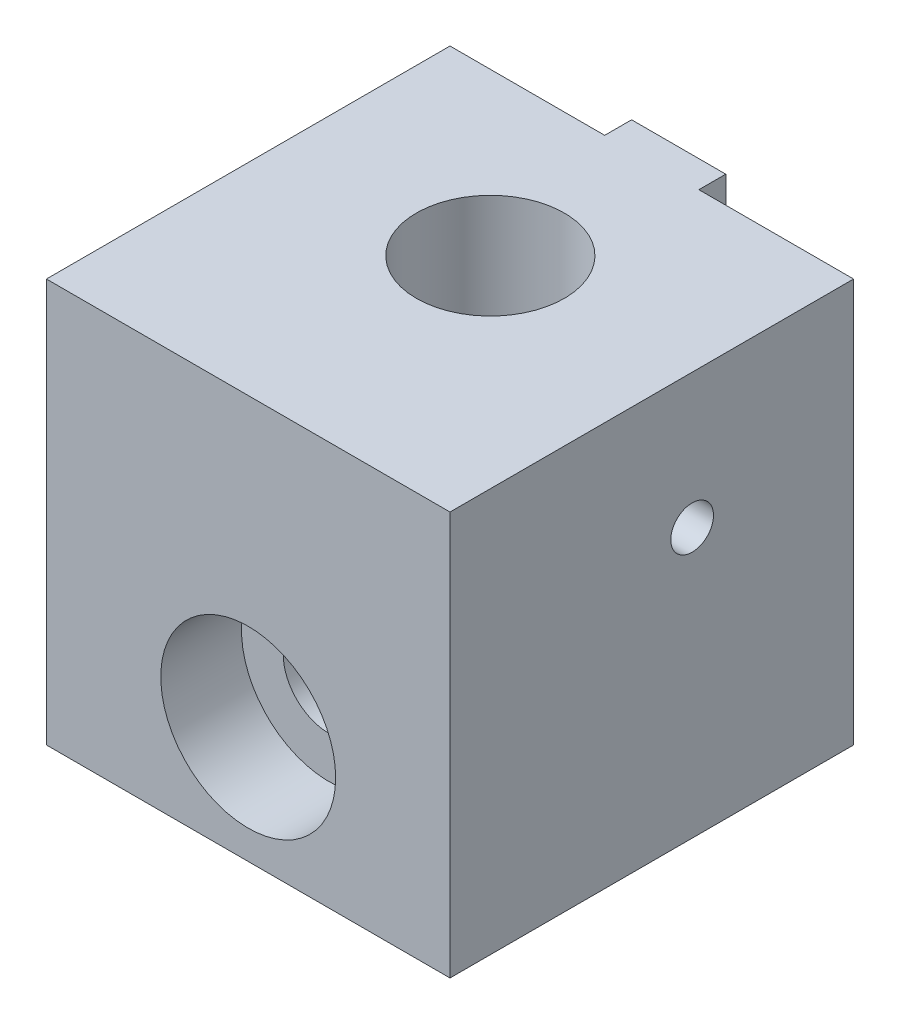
SolidWorks part; units mm, degrees
ref_plane "Front Plane" through (0, 0, 0) normal (0, 0, 1) x (1, 0, 0)
ref_plane "Top Plane" through (0, 0, 0) normal (0, 1, 0) x (1, 0, 0)
ref_plane "Right Plane" through (0, 0, 0) normal (1, 0, 0) x (0, 0, -1)
sketch "Sketch1" plane through (0, 0, 0) normal (0, 0, 1) x (1, 0, 0)
  line L1 (-7.5, -7.5) -> (7.5, -7.5)
  line L2 (-7.5, -7.5) -> (-7.5, 7.5)
  line L3 (-7.5, 7.5) -> (7.5, 7.5)
  line L4 (7.5, -7.5) -> (7.5, 7.5)
  line L5 (-7.5, -7.5) -> (7.5, 7.5) construction
  line L6 (-7.5, 7.5) -> (7.5, -7.5) construction
  point P0 (0, 0)
  dimension "D1" = 15
  dimension "D2" = 15
extrude "Boss-Extrude1" add sketch "Sketch1" along normal blind 15
sketch "Sketch8" plane through (0, 0, 0) normal (0, 0, -1) x (-1, 0, 0)
  line L0 (-7.5, 7.5) -> (7.5, 7.5) construction
  line L1 (-1.75, -7.5) -> (1.75, -7.5)
  line L2 (-1.75, -7.5) -> (-1.75, 7.5)
  line L3 (-1.75, 7.5) -> (1.75, 7.5)
  line L4 (1.75, -7.5) -> (1.75, 7.5)
  line L5 (-1.75, -7.5) -> (1.75, 7.5) construction
  line L6 (-1.75, 7.5) -> (1.75, -7.5) construction
  point P0 (0, 0)
  dimension "D1" = 3.5
extrude "Boss-Extrude2" add sketch "Sketch8" along normal blind 1
hole_wizard "CBORE for M3 SHCS1" positions "Sketch5" profile "Sketch4" counterbore size "M3" standard "ANSI Metric"
sketch "Sketch5" plane through (0, 0, 15) normal (0, 0, 1) x (1, 0, 0)
  point P0 (0, -3.1778)
sketch "Sketch4" plane through (0, -3.1778, 15) normal (1, 0, 0) x (0, -1, 0)
  line L0 (0, 0) -> (0, 16)
  line L1 (0, 16) -> (1.7, 16)
  line L3 (1.7, 16) -> (1.7, 3)
  line L4 (1.7, 3) -> (3.25, 3)
  line L5 (3.25, 3) -> (3.25, 0)
  line L7 (3.25, 0) -> (0, 0)
  line L11 (0, -6.35) -> (0, 107.95) construction
  dimension "Thru Hole Dia." = 3.4
  dimension "Thru Hole Depth" = 16
  dimension "C'Bore Dia." = 6.5
  dimension "C'Bore Depth" = 3
sketch "Sketch6" plane through (0, 7.5, 0) normal (0, 1, 0) x (1, 0, 0)
  line L0 (0, 1) -> (0, -6) construction
  line L1 (-1.75, 1) -> (1.75, 1) construction
  line L2 (7.5, 0) -> (1.75, 0) construction
  circle A0 centre (0, -6) radius 2.75
  dimension "D1" = 5.5
  dimension "D2" = 6
extrude "Cut-Extrude1" cut sketch "Sketch6" against normal blind 8
sketch "Sketch7" plane through (0, 0, 0) normal (0, 0, -1) x (-1, 0, 0)
  line L0 (0, 2.5) -> (0, 7.5) construction
  line L2 (1.75, 7.5) -> (-1.75, 7.5) construction
  circle A0 centre (0, 2.5) radius 0.7938
  dimension "D1" = 1.5875
  dimension "D2" = 5
extrude "Cut-Extrude2" [suppressed] cut sketch "Sketch7" against normal up to next
hole_wizard "1/16 (0.0625) Diameter Hole1" positions "Sketch10" profile "Sketch9" hole size "1/16" standard "ANSI Inch"
sketch "Sketch10" plane through (7.5, 0, 0) normal (1, 0, 0) x (0, 0, -1)
  line L1 (-6, -0.5) -> (-6, 7.5) construction
  line L2 (-15, 7.5) -> (0, 7.5) construction
  point P0 (-6, 2.5)
  dimension "D1" = 5
sketch "Sketch9" plane through (7.5, 2.5, 6) normal (0, 1, 0) x (0, 0, -1)
  line L0 (0, 0) -> (0, 4.75)
  line L1 (0, 4.75) -> (0.7937, 4.75)
  line L2 (0.7937, 4.75) -> (0.7937, 0)
  line L5 (0.7937, 0) -> (0, 0)
  line L11 (0, -6.35) -> (0, 107.95) construction
  dimension "Thru Hole Dia." = 1.5875
  dimension "Thru Hole Depth" = 4.75
